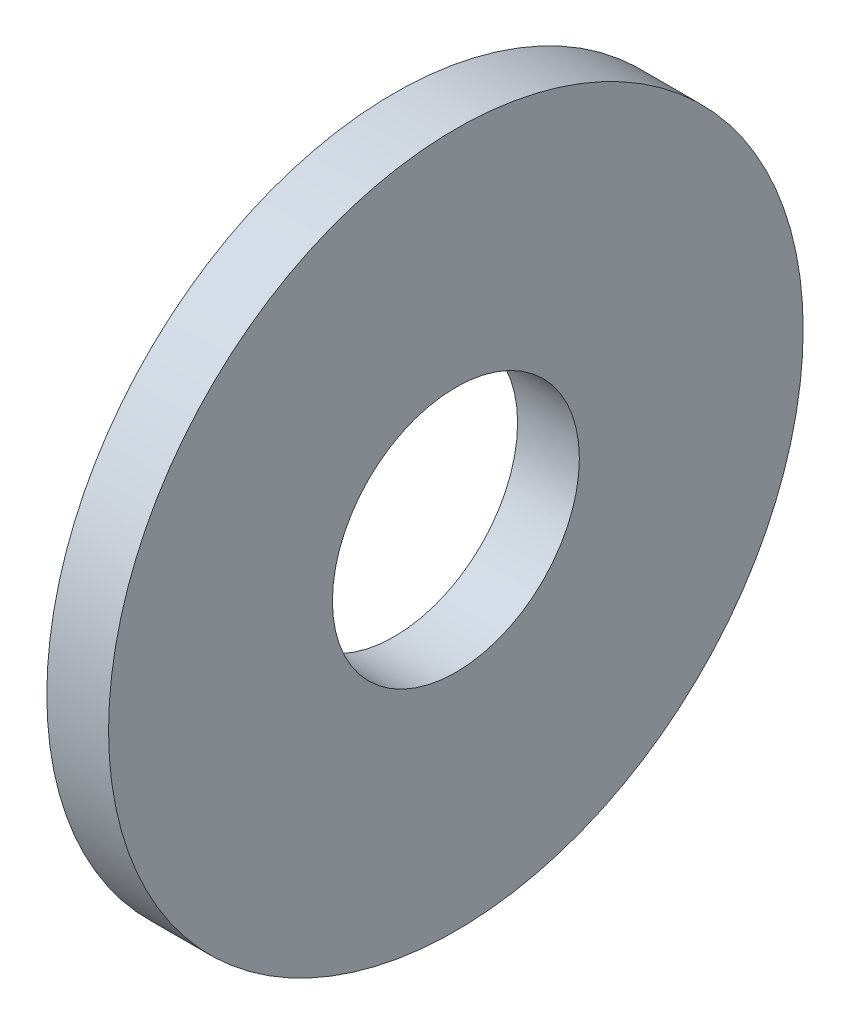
SolidWorks part; units mm, degrees
ref_plane "Plane1" through (0, 0, 0) normal (0, 0, 1) x (1, 0, 0)
ref_plane "Plane2" through (0, 0, 0) normal (0, 1, 0) x (1, 0, 0)
ref_plane "Plane3" through (0, 0, 0) normal (1, 0, 0) x (0, 0, -1)
revolve "Base-Revolve" add sketch "Sketch1" angle 360 about L0
sketch "Sketch1" plane through (0, 0, 0) normal (0, 0, 1) x (1, 0, 0)
  line L0 (-34.925, 0) -> (9.525, 0) construction
  line L1 (0, 1.6) -> (0, 4.5)
  line L2 (0, 4.5) -> (-0.8, 4.5)
  line L3 (-0.8, 4.5) -> (-0.8, 1.6)
  line L4 (-0.8, 1.6) -> (0, 1.6)
  dimension "Thickness" = 0.8
  dimension "Inside_dia" = 3.2
  dimension "Outside_dia" = 9
